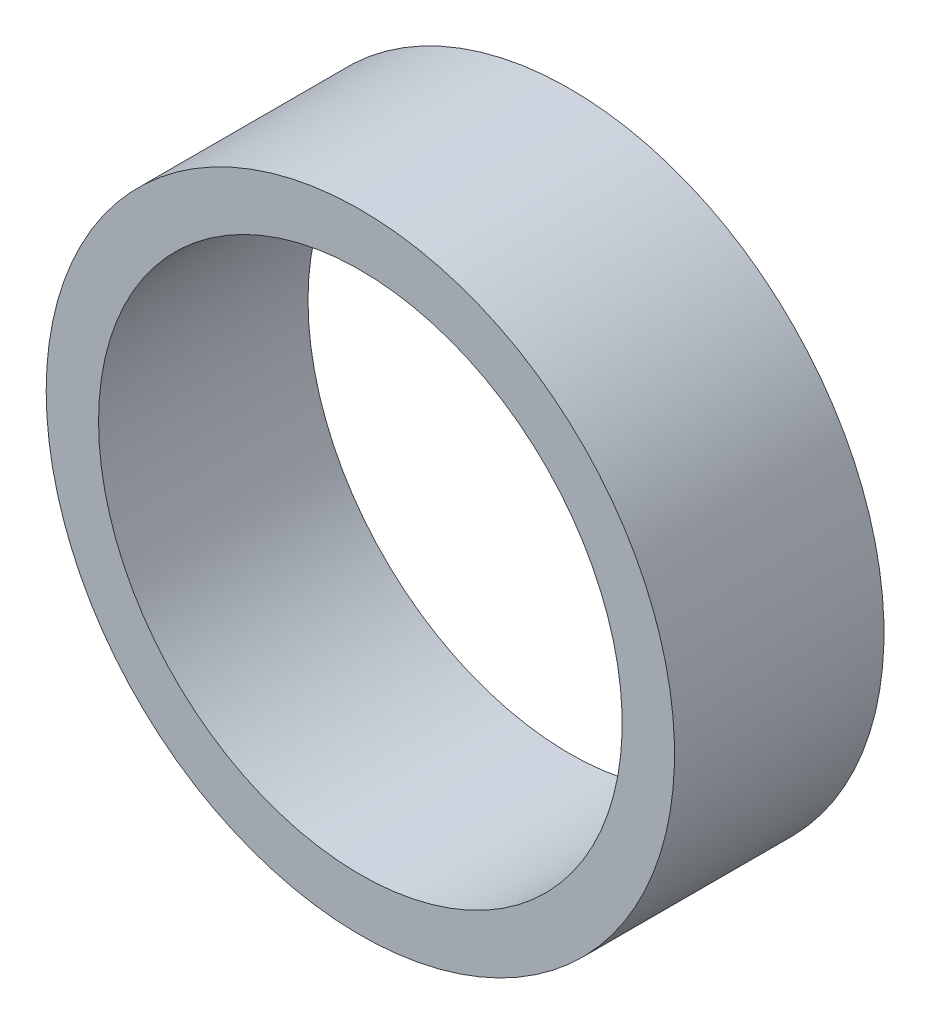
SolidWorks part; units mm, degrees
ref_plane "Front" through (0, 0, 0) normal (0, 0, 1) x (1, 0, 0)
ref_plane "Top" through (0, 0, 0) normal (0, 1, 0) x (1, 0, 0)
ref_plane "Right" through (0, 0, 0) normal (1, 0, 0) x (0, 0, -1)
sketch "Logo3_Revol_Axis" plane through (0, 0, 0) normal (0, 1, 0) x (1, 0, 0)
  line L0 (0, -30.1653) -> (0, 30.1653) construction
sketch "Logo3_bib1" plane through (0, 0, 0) normal (0, -1, 0) x (-1, 0, 0)
  line L0 (9.525, 0) -> (7.9375, 0)
  line L1 (7.9375, 0) -> (7.9375, -6.35)
  line L2 (7.9375, -6.35) -> (9.525, -6.35)
  line L3 (8.7313, 0) -> (8.7313, -6.35) construction
  line L4 (9.525, -6.35) -> (9.525, 0)
  line L5 (9.525, -3.175) -> (7.9375, -3.175) construction
  line L10 (0, 38.9764) -> (0, -41.3764) construction
  point P11 (7.9375, 0)
  point P15 (7.9375, -6.35)
revolve "Revolve1" add sketch "Logo3_bib1" angle 360 about L10
equation "\"D2@Logo3_bib1\"=\"logo3_l1@Logo3_bib1\"/2"
equation "\"D3@Logo3_bib1\"=(\"logo3_d1@Logo3_bib1\"-\"logo3_d_in@Logo3_bib1\")/4"
